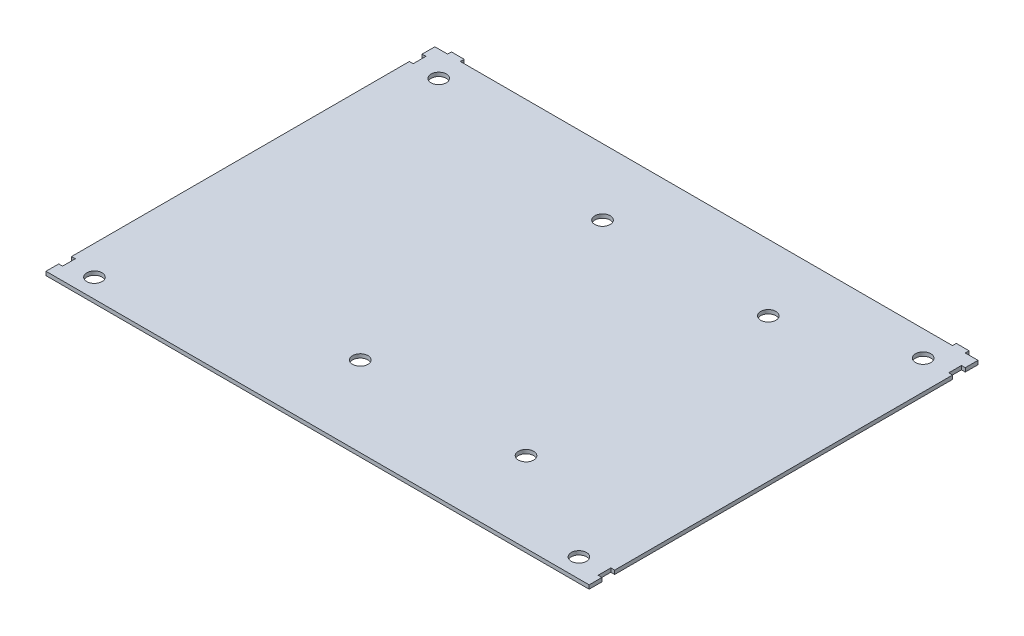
SolidWorks part; units mm, degrees
ref_plane "Спереди" through (0, 0, 0) normal (0, 0, 1) x (1, 0, 0)
ref_plane "Сверху" through (0, 0, 0) normal (0, 1, 0) x (1, 0, 0)
ref_plane "Справа" through (0, 0, 0) normal (1, 0, 0) x (0, 0, -1)
sketch "Эскиз1" plane through (0, 0, 0) normal (0, 1, 0) x (1, 0, 0)
  line L1 (0, 300) -> (530, 300)
  line L2 (0, 300) -> (0, 0)
  line L3 (0, 0) -> (530, 0)
  line L4 (530, 300) -> (530, 0)
  dimension "D2" = 300
  dimension "D4" = 530
extrude "Бобышка-Вытянуть1" add sketch "Эскиз1" along normal blind 3
sketch "Эскиз3" plane through (0, 3, 0) normal (0, 1, 0) x (1, 0, 0)
  line L0 (0, 300) -> (0, 0) construction
  line L1 (0, 260) -> (79, 260)
  line L2 (0, 260) -> (0, 60)
  line L3 (0, 60) -> (79, 60)
  line L4 (79, 260) -> (79, 60)
  line L6 (0, 0) -> (530, 0) construction
  dimension "D1" = 200
  dimension "D2" = 79
  dimension "D3" = 60
extrude "Вырез-Вытянуть2" cut sketch "Эскиз3" against normal through all
fillet "Скругление2" radius 5 2 edges at (79, 1.5, -60) (79, 1.5, -260)
sketch "Эскиз4" plane through (0, 3, 0) normal (0, 1, 0) x (1, 0, 0)
  line L0 (0, 0) -> (530, 0) construction
  line L1 (0, 300) -> (27.5, 300)
  line L2 (0, 300) -> (0, 0)
  line L3 (0, 0) -> (27.5, 0)
  line L4 (27.5, 300) -> (27.5, 0)
  dimension "D1" = 27.5
extrude "Вырез-Вытянуть3" cut sketch "Эскиз4" against normal through all
sketch "Эскиз7" plane through (0, 3, 0) normal (0, 1, 0) x (1, 0, 0)
  line L1 (530, 300) -> (700, 300)
  line L2 (530, 300) -> (530, 0)
  line L3 (530, 0) -> (700, 0)
  line L4 (700, 300) -> (700, 0)
  dimension "D1" = 170
extrude "Бобышка-Вытянуть2" add sketch "Эскиз7" against normal up to surface (3 mm away)
sketch "Эскиз8" plane through (0, 3, 0) normal (0, 1, 0) x (1, 0, 0)
  line L0 (700, 300) -> (27.5, 300) construction
  line L1 (530, 300) -> (700, 300)
  line L2 (530, 300) -> (530, 160)
  line L3 (530, 160) -> (700, 160)
  line L4 (700, 300) -> (700, 160)
  line L5 (700, 0) -> (700, 300) construction
  line L6 (27.5, 0) -> (700, 0) construction
  dimension "D1" = 170
  dimension "D2" = 160
extrude "Вырез-Вытянуть4" cut sketch "Эскиз8" against normal through all
sketch "Эскиз11" plane through (0, 0, 0) normal (0, -1, 0) x (1, 0, 0)
  line L0 (27.5, 0) -> (700, 0) construction
  line L1 (27.5, -60) -> (-20, -60)
  line L2 (27.5, -60) -> (27.5, 0)
  line L3 (530, -300) -> (27.5, -300) construction
  line L4 (-20, -60) -> (-20, 0)
  line L6 (27.5, -300) -> (-20, -300)
  line L7 (-20, -260) -> (-20, -300)
  line L8 (27.5, -260) -> (-20, -260)
  line L9 (27.5, -260) -> (27.5, -300)
  line L10 (27.5, 0) -> (-20, 0)
  line L11 (27.5, -260) -> (27.5, -300) construction
extrude "Бобышка-Вытянуть3" add sketch "Эскиз11" against normal up to surface (3 mm away)
hole_wizard "Диаметр отверстия Ø10.0 (10)1" positions "Эскиз12" profile "Эскиз14" hole size "Ø10.0" standard "ISO"
sketch "Эскиз12" plane through (0, 3, 0) normal (0, 1, 0) x (1, 0, 0)
  line L0 (700, 80) -> (135.4022, 80) construction
  line L1 (700, 0) -> (700, 160) construction
  point P0 (547.5, 152.5)
  point P2 (692.5, 152.5)
  point P4 (692.5, 7.5)
  point P6 (547.5, 7.5)
  dimension "D1" = 145
  dimension "D2" = 145
  dimension "D3" = 7.5
sketch "Эскиз14" plane through (547.5, 3, -152.5) normal (1, 0, 0) x (0, 0, 1)
  line L0 (0, 0) -> (0, 3)
  line L1 (0, 3) -> (5, 3)
  line L2 (5, 3) -> (5, 0)
  line L5 (5, 0) -> (0, 0)
  line L11 (0, -6.35) -> (0, 107.95) construction
  dimension "Диаметр сквозного отверстия" = 10
  dimension "Глубина сквозного отверстия" = 3
sketch "Эскиз16" plane through (0, 0, 0) normal (0, -1, 0) x (1, 0, 0)
  line L1 (-20, -60) -> (1, -60)
  line L2 (-20, -60) -> (-20, -260)
  line L3 (-20, -260) -> (1, -260)
  line L4 (1, -60) -> (1, -260)
  line L5 (74, -260) -> (-20, -260) construction
  dimension "D1" = 21
extrude "Бобышка-Вытянуть5" add sketch "Эскиз16" against normal up to surface (3 mm away)
fillet "Скругление4" radius 5 2 edges at (1, 1.5, -260) (1, 1.5, -60)
sketch "Эскиз18" plane through (0, 3, 0) normal (0, 1, 0) x (1, 0, 0)
  line L0 (700, 0) -> (700, 160) construction
  line L1 (700, 160) -> (707, 160)
  line L2 (700, 160) -> (700, 0)
  line L3 (700, 0) -> (707, 0)
  line L4 (707, 160) -> (707, 0)
  line L6 (-20, 0) -> (700, 0) construction
  dimension "D1" = 7
extrude "Бобышка-Вытянуть7" add sketch "Эскиз18" against normal up to surface (3 mm away)
sketch "Эскиз19" plane through (0, 3, 0) normal (0, 1, 0) x (1, 0, 0)
  line L1 (530, 160) -> (707, 160)
  line L2 (530, 160) -> (530, 0)
  line L3 (530, 0) -> (707, 0)
  line L4 (707, 160) -> (707, 0)
extrude "Вырез-Вытянуть5" cut sketch "Эскиз19" against normal through all
sketch "Эскиз21" plane through (0, 3, 0) normal (0, 1, 0) x (1, 0, 0)
  line L0 (-20, 0) -> (530, 0) construction
  line L1 (530, 300) -> (640, 300)
  line L2 (530, 300) -> (530, 0)
  line L3 (530, 0) -> (640, 0)
  line L4 (640, 300) -> (640, 0)
  dimension "D1" = 110
extrude "Бобышка-Вытянуть8" add sketch "Эскиз21" against normal up to surface (3 mm away)
sketch "Эскиз20" plane through (0, 3, 0) normal (0, 1, 0) x (1, 0, 0)
  line L0 (-20, 0) -> (640, 0) construction
  line L2 (640, 0) -> (640, 300) construction
  circle A0 centre (527.5, 55) radius 6
  circle A1 centre (397.5, 55) radius 6
  circle A2 centre (397.5, 245) radius 6
  circle A3 centre (527.5, 245) radius 6
  dimension "D1" = 12
  dimension "D2" = 55
  dimension "D4" = 190
  dimension "D5" = 112.5
  dimension "D3" = 130
extrude "Вырез-Вытянуть6" cut sketch "Эскиз20" against normal through all
sketch "Эскиз22" plane through (0, 3, 0) normal (0, 1, 0) x (1, 0, 0)
  line L0 (1, 255) -> (1, 65) construction
  line L1 (1, 150) -> (79, 150)
  line L2 (1, 150) -> (1, 60)
  line L3 (1, 60) -> (79, 60)
  line L4 (79, 150) -> (79, 60)
  line L5 (79, 65) -> (79, 255) construction
  line L6 (6, 60) -> (74, 60) construction
  line L7 (74, 260) -> (6, 260) construction
  dimension "D1" = 110
extrude "Бобышка-Вытянуть9" add sketch "Эскиз22" against normal up to surface (3 mm away)
fillet "Скругление5" radius 5 2 edges at (1, 1.5, -150) (79, 1.5, -150)
hole_wizard "Диаметр отверстия Ø12.0 (12)1" positions "Эскиз9" profile "Эскиз10" hole size "Ø12.0" standard "ISO"
sketch "Эскиз9" plane through (0, 3, 0) normal (0, 1, 0) x (1, 0, 0)
  line L0 (640, 300) -> (-20, 300) construction
  line L3 (640, 0) -> (640, 300) construction
  point P0 (617, 277)
  point P2 (617, 7)
  point P4 (237, 7)
  point P6 (237, 277)
  dimension "D1" = 23
  dimension "D2" = 23
  dimension "D3" = 380
  dimension "D4" = 270
sketch "Эскиз10" plane through (617, 3, -277) normal (1, 0, 0) x (0, 0, 1)
  line L0 (0, 0) -> (0, 3)
  line L1 (0, 3) -> (6, 3)
  line L2 (6, 3) -> (6, 0)
  line L5 (6, 0) -> (0, 0)
  line L11 (0, -6.35) -> (0, 107.95) construction
  dimension "Диаметр сквозного отверстия" = 12
  dimension "Глубина сквозного отверстия" = 3
hole_wizard "Диаметр отверстия Ø12.0 (12)2" positions "Эскиз5" profile "Эскиз6" hole size "Ø12.0" standard "ISO"
sketch "Эскиз5" plane through (0, 0, 0) normal (0, -1, 0) x (-1, 0, 0)
  line L8 (20, 0) -> (20, 300) construction
  line L9 (20, 0) -> (-640, 0) construction
  point P0 (-41, 43.5)
  point P2 (-191, 43.5)
  point P4 (-191, 276.5)
  point P6 (-41, 276.5)
  dimension "D1" = 61
  dimension "D2" = 233
  dimension "D3" = 150
  dimension "D4" = 43.5
sketch "Эскиз6" plane through (41, 0, -43.5) normal (1, 0, 0) x (0, 0, -1)
  line L0 (0, 0) -> (0, 3)
  line L1 (0, 3) -> (6, 3)
  line L2 (6, 3) -> (6, 0)
  line L5 (6, 0) -> (0, 0)
  line L11 (0, -6.35) -> (0, 107.95) construction
  dimension "Диаметр сквозного отверстия" = 12
  dimension "Глубина сквозного отверстия" = 3
sketch "Эскиз23" plane through (0, 0, 0) normal (0, -1, 0) x (1, 0, 0)
  line L0 (-20, 0) -> (-20, -300) construction
  line L1 (-20, -43) -> (-17, -43)
  line L2 (-20, -43) -> (-20, -53)
  line L3 (-20, -53) -> (-17, -53)
  line L4 (-17, -43) -> (-17, -53)
  line L5 (-17, -282) -> (12.7851, -282) construction
  line L6 (-20, -277) -> (-17, -277)
  line L7 (-20, -277) -> (-20, -287)
  line L8 (-20, -287) -> (-17, -287)
  line L9 (-17, -277) -> (-17, -287)
  line L10 (640, -300) -> (-20, -300) construction
  line L11 (-17, -48) -> (8.4334, -48) construction
  line L12 (-20, 0) -> (640, 0) construction
  dimension "D1" = 10
  dimension "D2" = 3
  dimension "D3" = 18
  dimension "D4" = 48
  dimension "D5" = 234
extrude "Вырез-Вытянуть7" cut sketch "Эскиз23" against normal through all
sketch "Эскиз27" plane through (0, 0, 0) normal (0, -1, 0) x (1, 0, 0)
  line L0 (640, -300) -> (640, 0) construction
  line L1 (640, -277) -> (637, -277)
  line L2 (640, -277) -> (640, -287)
  line L3 (640, -287) -> (637, -287)
  line L4 (637, -277) -> (637, -287)
  line L5 (640, -282) -> (560.6555, -282) construction
  line L6 (640, -300) -> (-20, -300) construction
  line L7 (640, -7) -> (569.4363, -7) construction
  line L8 (640, -2) -> (637, -2)
  line L9 (640, -2) -> (640, -12)
  line L10 (640, -12) -> (637, -12)
  line L11 (637, -2) -> (637, -12)
  line L12 (-20, 0) -> (640, 0) construction
  dimension "D1" = 3
  dimension "D2" = 10
  dimension "D3" = 18
  dimension "D4" = 7
  dimension "D5" = 275
extrude "Вырез-Вытянуть10" cut sketch "Эскиз27" against normal through all
sketch "Эскиз28" plane through (0, 3, 0) normal (0, 1, 0) x (1, 0, 0)
  line L0 (125.5, 288) -> (125.5, 276) construction
  line L1 (127, 288) -> (127, 276)
  line L2 (124, 288) -> (124, 276)
  line L3 (125.5, 282) -> (-17, 282) construction
  line L4 (-17, 287) -> (-17, 277) construction
  line L5 (125.5, 54) -> (125.5, 42) construction
  line L7 (-18.5, 287) -> (-18.5, 325.4151) construction
  line L8 (-20, 287) -> (-17, 287) construction
  line L9 (127, 54) -> (127, 42)
  line L10 (124, 54) -> (124, 42)
  line L11 (125.5, 48) -> (-17, 48) construction
  line L12 (-17, 53) -> (-17, 43) construction
  arc A0 (127, 288) -> (124, 288) centre (125.5, 288) ccw
  arc A1 (124, 276) -> (127, 276) centre (125.5, 276) ccw
  arc A2 (127, 54) -> (124, 54) centre (125.5, 54) ccw
  arc A3 (124, 42) -> (127, 42) centre (125.5, 42) ccw
  point P2 (125.5, 282)
  point P18 (125.5, 48)
  dimension "D1" = 12
  dimension "D2" = 3
  dimension "D4" = 144
extrude "Вырез-Вытянуть11" cut sketch "Эскиз28" against normal through all
sketch "Эскиз29" plane through (0, 0, 0) normal (0, -1, 0) x (1, 0, 0)
  line L0 (-20, 0) -> (640, 0) construction
  line L1 (214, 0) -> (640, 0)
  line L2 (214, 0) -> (214, 8)
  line L3 (214, 8) -> (640, 8)
  line L4 (640, 0) -> (640, 8)
  dimension "D1" = 8
  dimension "D2" = 426
extrude "Бобышка-Вытянуть10" add sketch "Эскиз29" against normal up to surface (3 mm away)
sketch "Эскиз31" plane through (0, 3, 0) normal (0, 1, 0) x (1, 0, 0)
  line L0 (214, -8) -> (214, 0) construction
  line L1 (-20, 0) -> (214, 0)
  line L2 (-20, 0) -> (-20, 30)
  line L3 (-20, 30) -> (214, 30)
  line L4 (214, 0) -> (214, 30)
  line L5 (-20, 0) -> (214, 0) construction
  dimension "D1" = 30
extrude "Вырез-Вытянуть13" cut sketch "Эскиз31" against normal through all
sketch "Эскиз32" plane through (0, 3, 0) normal (0, 1, 0) x (1, 0, 0)
  line L1 (132.7371, 38.9005) -> (118.0838, 38.9005)
  line L2 (132.7371, 38.9005) -> (132.7371, 58.2879)
  line L3 (132.7371, 58.2879) -> (118.0838, 58.2879)
  line L4 (118.0838, 38.9005) -> (118.0838, 58.2879)
extrude "Бобышка-Вытянуть11" add sketch "Эскиз32" against normal up to surface (3 mm away)
sketch "Эскиз33" plane through (0, 3, 0) normal (0, 1, 0) x (1, 0, 0)
  line L0 (214, -8) -> (214, 30) construction
  line L1 (214, 12) -> (217, 12)
  line L2 (214, 12) -> (214, 2)
  line L3 (214, 2) -> (217, 2)
  line L4 (217, 12) -> (217, 2)
  line L5 (214, 7) -> (97.6734, 7) construction
  line L6 (640, -8) -> (214, -8) construction
  dimension "D1" = 3
  dimension "D2" = 10
  dimension "D3" = 15
extrude "Вырез-Вытянуть14" cut sketch "Эскиз33" against normal through all
sketch "Эскиз34" plane through (0, 0, 0) normal (0, -1, 0) x (1, 0, 0)
  line L0 (214, -30) -> (-20, -30) construction
  line L1 (-7, -30) -> (1, -30)
  line L2 (-7, -30) -> (-7, -33)
  line L3 (-7, -33) -> (1, -33)
  line L4 (1, -30) -> (1, -33)
  line L5 (-3, -30) -> (-3, -17.9839) construction
  line L6 (193, -30) -> (201, -30)
  line L7 (193, -30) -> (193, -33)
  line L8 (193, -33) -> (201, -33)
  line L9 (201, -30) -> (201, -33)
  line L10 (197, -30) -> (197, -9.9948) construction
  line L11 (-20, -30) -> (-20, -43) construction
  line L12 (214, -12) -> (214, -30) construction
  dimension "D1" = 3
  dimension "D2" = 8
  dimension "D3" = 17
  dimension "D4" = 17
  dimension "D5" = 200
extrude "Вырез-Вытянуть15" cut sketch "Эскиз34" against normal through all
sketch "Эскиз36" plane through (0, 0, 0) normal (0, -1, 0) x (1, 0, 0)
  line L1 (242.9245, -34.9142) -> (257.8646, -34.9142)
  line L2 (242.9245, -34.9142) -> (242.9245, -62.0362)
  line L3 (242.9245, -62.0362) -> (257.8646, -62.0362)
  line L4 (257.8646, -34.9142) -> (257.8646, -62.0362)
extrude "Бобышка-Вытянуть12" add sketch "Эскиз36" against normal up to surface (3 mm away)
sketch "Эскиз38" plane through (0, 3, 0) normal (0, 1, 0) x (1, 0, 0)
  line L1 (-20, 300) -> (214, 300)
  line L2 (-20, 300) -> (-20, 30)
  line L3 (-20, 30) -> (214, 30)
  line L4 (214, 300) -> (214, 30)
extrude "Вырез-Вытянуть18" cut sketch "Эскиз38" against normal through all
sketch "Эскиз39" plane through (0, 3, 0) normal (0, 1, 0) x (1, 0, 0)
  line L0 (640, 287) -> (640, 300) construction
  line L1 (214, 300) -> (640, 300)
  line L2 (214, 300) -> (214, 297)
  line L3 (214, 297) -> (640, 297)
  line L4 (640, 300) -> (640, 297)
  dimension "D1" = 3
extrude "Вырез-Вытянуть19" cut sketch "Эскиз39" against normal through all
sketch "Эскиз40" plane through (0, 0, 0) normal (0, -1, 0) x (1, 0, 0)
  line L0 (214, -12) -> (214, -297) construction
  line L1 (214, -277) -> (217, -277)
  line L2 (214, -277) -> (214, -287)
  line L3 (214, -287) -> (217, -287)
  line L4 (217, -277) -> (217, -287)
  line L5 (214, -282) -> (183.0777, -282) construction
  line L6 (214, -297) -> (640, -297) construction
  dimension "D1" = 3
  dimension "D2" = 10
  dimension "D3" = 15
extrude "Вырез-Вытянуть20" cut sketch "Эскиз40" against normal through all
sketch "Эскиз41" plane through (0, 3, 0) normal (0, 1, 0) x (1, 0, 0)
  line L1 (620, 300) -> (630, 300)
  line L2 (620, 300) -> (620, 297)
  line L3 (620, 297) -> (630, 297)
  line L4 (630, 300) -> (630, 297)
  line L5 (625, 297) -> (625, 335.0038) construction
  line L6 (640, -8) -> (640, 2) construction
  line L7 (214, 297) -> (640, 297) construction
  line L8 (229, 300) -> (229, 308.1086) construction
  line L9 (224, 297) -> (234, 297)
  line L10 (224, 297) -> (224, 300)
  line L11 (224, 300) -> (234, 300)
  line L12 (234, 297) -> (234, 300)
  line L13 (214, 287) -> (214, 297) construction
  dimension "D1" = 3
  dimension "D2" = 10
  dimension "D3" = 15
  dimension "D4" = 15
extrude "Бобышка-Вытянуть13" add sketch "Эскиз41" against normal up to surface (3 mm away)
